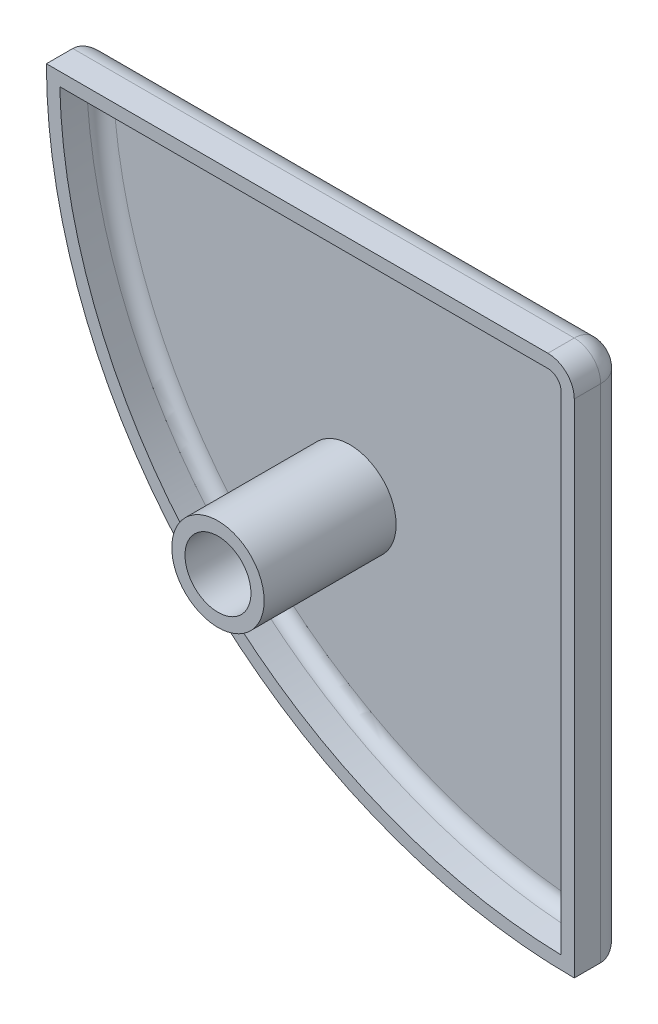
SolidWorks part; units mm, degrees
ref_plane "前视基准面" through (0, 0, 0) normal (0, 0, 1) x (1, 0, 0)
ref_plane "上视基准面" through (0, 0, 0) normal (0, 1, 0) x (1, 0, 0)
ref_plane "右视基准面" through (0, 0, 0) normal (1, 0, 0) x (0, 0, -1)
sketch "草图1" plane through (0, 0, 0) normal (0, 0, 1) x (1, 0, 0)
  line L1 (-20, 20) -> (20, 20)
  line L4 (20, 20) -> (20, -20)
  arc A0 (-20, 20) -> (20, -20) centre (20, 20) ccw
  dimension "D1" = 40
  dimension "D3" = 20
extrude "凸台-拉伸1" add sketch "草图1" along normal mid plane 4
fillet "圆角1" radius 2 4 edges at (20, 0, -2) (20, 20, 0) (0, 20, -2) (-8.2843, -8.2843, -2)
shell "抽壳1" thickness 1
sketch "草图2" plane through (0, 0, -1) normal (0, 0, 1) x (1, 0, 0)
  circle A0 centre (0, 0) radius 3.5
  circle A1 centre (0, 0) radius 2.5
  dimension "D1" = 7
  dimension "D2" = 5
extrude "凸台-拉伸2" add sketch "草图2" along normal blind 10
